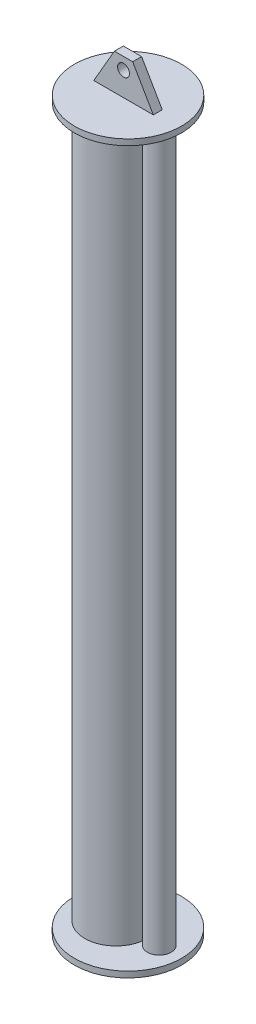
SolidWorks part; units mm, degrees
ref_plane "Front Plane" through (0, 0, 0) normal (0, 0, 1) x (1, 0, 0)
ref_plane "Top Plane" through (0, 0, 0) normal (0, 1, 0) x (1, 0, 0)
ref_plane "Right Plane" through (0, 0, 0) normal (1, 0, 0) x (0, 0, -1)
sketch "Sketch1" plane through (0, 0, 0) normal (0, 1, 0) x (1, 0, 0)
  line L1 (-16.6691, 6.9725) -> (-15.3278, 6.9725)
  line L3 (-16.6691, -6.9725) -> (-15.3278, -6.9725)
  line L5 (-61.6285, 6.9725) -> (-5.1513, -6.9725) construction
  line L6 (-61.6285, -6.9725) -> (-5.1513, 6.9725) construction
  arc A0 (-15.3278, -6.9725) -> (-15.3278, 6.9725) centre (9.0965, 0) ccw
  arc A1 (-16.6691, 6.9725) -> (-16.6691, -6.9725) centre (-82.9785, 0) ccw
  circle A2 centre (-82.9785, 0) radius 60.325
  circle A3 centre (9.0965, 0) radius 19.05
  point P7 (-33.3899, 0)
  dimension "D1" = 50.8
  dimension "D2" = 133.35
  dimension "D3" = 6.35
  dimension "D4" = 6.35
extrude "Boss-Extrude1" add sketch "Sketch1" along normal blind 1524
sketch "Sketch2" plane through (0, 0, 0) normal (0, -1, 0) x (1, 0, 0)
  circle A0 centre (-57.5785, 0) radius 92.075 construction
  arc A1 (-15.3278, -6.9725) -> (-15.3278, 6.9725) centre (9.0965, 0) ccw construction
  arc A2 (-16.6691, 6.9725) -> (-16.6691, -6.9725) centre (-82.9785, 0) ccw construction
  circle A3 centre (-57.5785, 0) radius 114.3
  circle A4 centre (-82.9785, 0) radius 12.7
  circle A5 centre (9.0965, 0) radius 9.525
  dimension "D1" = 184.15
  dimension "D2" = 228.6
  dimension "D3" = 25.4
  dimension "D4" = 19.05
extrude "Boss-Extrude2" add sketch "Sketch2" along normal blind 12.7
sketch "Sketch3" plane through (0, 1524, 0) normal (0, 1, 0) x (1, 0, 0)
  circle A1 centre (-57.5785, 0) radius 114.3 construction
  circle A2 centre (-57.5785, 0) radius 114.3
extrude "Boss-Extrude3" add sketch "Sketch3" along normal blind 12.7
sketch "Sketch4" plane through (0, 0, 0) normal (0, 0, 1) x (1, 0, 0)
  line L0 (-57.5785, 1536.7) -> (-57.5785, 2095.1717) construction
  line L1 (56.7215, 1536.7) -> (-171.8785, 1536.7) construction
  line L2 (5.9215, 1536.7) -> (-121.0785, 1536.7)
  line L3 (-121.0785, 1536.7) -> (-77.0845, 1612.9)
  line L4 (-77.0845, 1612.9) -> (-38.0726, 1612.9)
  line L5 (5.9215, 1536.7) -> (-38.0726, 1612.9)
  circle A0 centre (-57.5785, 1587.5) radius 12.7
  point P8 (-57.5785, 1612.9)
  dimension "D3" = 25.4
  dimension "D1" = 127
  dimension "D2" = 76.2
  dimension "D4" = 50.8
  dimension "D5" = 60
extrude "Boss-Extrude4" add sketch "Sketch4" along normal mid plane 19.05
